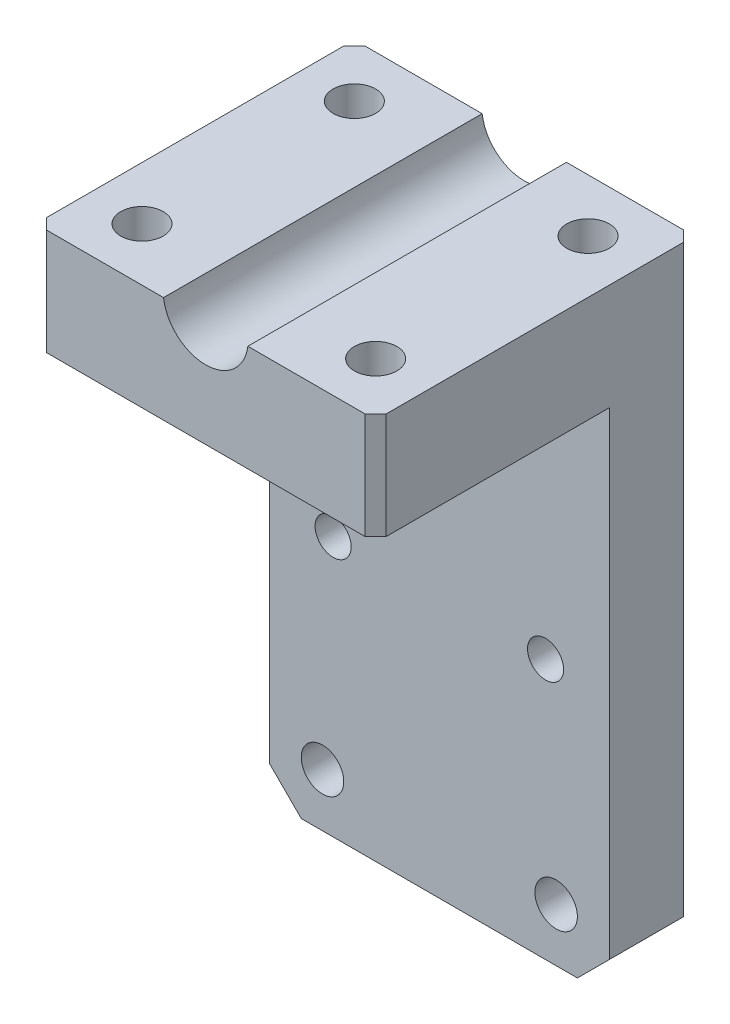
SolidWorks part; units mm, degrees
ref_plane "Aufriss" through (0, 0, 0) normal (0, 0, 1) x (1, 0, 0)
ref_plane "Grundriss" through (0, 0, 0) normal (0, 1, 0) x (1, 0, 0)
ref_plane "Seitenriss" through (0, 0, 0) normal (1, 0, 0) x (0, 0, -1)
sketch "Skizze1" plane through (0, 0, 0) normal (0, 0, 1) x (1, 0, 0)
  line L1 (-16, -29) -> (16, -29)
  line L2 (-16, -29) -> (-16, 29)
  line L3 (-16, 29) -> (16, 29)
  line L4 (16, -29) -> (16, 29)
  line L5 (-16, -29) -> (16, 29) construction
  line L6 (-16, 29) -> (16, -29) construction
  point P0 (0, 0)
  dimension "D1" = 32
  dimension "D2" = 58
extrude "Aufsatz-Linear austragen1" add sketch "Skizze1" against normal blind 30
sketch "Skizze2" plane through (16, 0, 0) normal (1, 0, 0) x (0, 0, -1)
  line L1 (22, -29) -> (0, -29)
  line L2 (22, -29) -> (22, 19)
  line L3 (22, 19) -> (0, 19)
  line L4 (0, -29) -> (0, 19)
  line L5 (30, 29) -> (0, 29) construction
  line L6 (30, -29) -> (30, 29) construction
  dimension "D1" = 10
  dimension "D2" = 8
extrude "Schnitt-Linear austragen1" cut sketch "Skizze2" against normal through all
hole_wizard "Stirnsenkung für M3 Flachkopfschraube mit Schlitz2" positions "Skizze3" profile "Skizze4" counterbore size "M3" standard "DIN"
sketch "Skizze3" plane through (0, 0, -30) normal (0, 0, 1) x (1, 0, 0)
  line L0 (-16, -29) -> (16, -29) construction
  line L1 (16, 29) -> (-16, 29) construction
  point P0 (-10, -4.5)
  point P2 (10, -4.5)
  point P11 (0, -29)
  point P12 (-10, 15.5)
  point P14 (10, 15.5)
  dimension "D1" = 10
  dimension "D2" = 10
  dimension "D3" = 20
  dimension "D4" = 13.5
sketch "Skizze4" plane through (-10, -4.5, -30) normal (1, 0, 0) x (0, 1, 0)
  line L0 (0, 0) -> (0, 30)
  line L1 (0, 30) -> (1.7, 30)
  line L3 (1.7, 30) -> (1.7, 2.4)
  line L4 (1.7, 2.4) -> (3.5, 2.4)
  line L5 (3.5, 2.4) -> (3.5, 0)
  line L7 (3.5, 0) -> (0, 0)
  line L11 (0, -6.35) -> (0, 107.95) construction
  dimension "Bohrerdurchmesser" = 3.4
  dimension "Bohrungstiefe" = 30
  dimension "Senkdurchmesser2" = 7
  dimension "Senktiefe2" = 2.4
hole_wizard "Ø4.0 (4) Durchmesser Bohrung1" positions "Skizze15" profile "Skizze16" hole size "Ø4.0" standard "DIN"
sketch "Skizze15" plane through (0, 0, -30) normal (0, 0, 1) x (1, 0, 0)
  line L3 (-16, -29) -> (-16, 19) construction
  line L4 (-16, -29) -> (16, -29) construction
  line L5 (16, -29) -> (16, 19) construction
  point P0 (-11, -24)
  point P2 (11, -24)
  dimension "D1" = 5
  dimension "D2" = 5
  dimension "D3" = 5
sketch "Skizze16" plane through (-11, -24, -30) normal (1, 0, 0) x (0, 1, 0)
  line L0 (0, 0) -> (0, 30)
  line L1 (0, 30) -> (2, 30)
  line L2 (2, 30) -> (2, 0)
  line L5 (2, 0) -> (0, 0)
  line L11 (0, -6.35) -> (0, 107.95) construction
  dimension "Bohrerdurchmesser" = 4
  dimension "Bohrungstiefe" = 30
chamfer "Fase2" distance 3 angle 45 2 edges at (-16, -29, -26) (16, -29, -26)
sketch "Skizze20" plane through (0, 0, -30) normal (0, 0, -1) x (-1, 0, 0)
  line L0 (-16, 29) -> (16, 29) construction
  circle A0 centre (0, 29.5) radius 4
  dimension "D2" = 8
  dimension "D1" = 0.5
extrude "Schnitt-Linear austragen3" cut sketch "Skizze20" against normal through all
hole_wizard "Ø4.0 (4) Durchmesser Bohrung2" positions "Skizze21" profile "Skizze22" hole size "Ø4.0" standard "DIN"
sketch "Skizze21" plane through (0, 29, 0) normal (0, 1, 0) x (1, 0, 0)
  line L0 (-16, 30) -> (-16, 0) construction
  line L1 (-3.9686, 30) -> (-16, 30) construction
  line L2 (-3.9686, 0) -> (-16, 0) construction
  line L3 (16, 30) -> (16, 0) construction
  point P0 (-11, 25)
  point P2 (11, 25)
  point P4 (11, 5)
  point P6 (-11, 5)
  dimension "D1" = 5
  dimension "D2" = 5
  dimension "D3" = 5
  dimension "D4" = 5
sketch "Skizze22" plane through (-11, 29, -25) normal (1, 0, 0) x (0, 0, 1)
  line L0 (0, 0) -> (0, 7)
  line L1 (0, 7) -> (2, 7)
  line L2 (2, 7) -> (2, 0)
  line L5 (2, 0) -> (0, 0)
  line L10 (0, 7) -> (-2, 7) construction
  line L11 (0, -6.35) -> (0, 107.95) construction
  dimension "Bohrerdurchmesser" = 4
  dimension "Bohrungstiefe" = 7
  dimension "Spitzenwinkel" = 180
chamfer "Fase3" distance 1 angle 45 7 edges at (-16, 1.5, -30) (-14.5, -27.5, -30) (0, -29, -30) (14.5, -27.5, -30) (16, 1.5, -30) (-16, 24, 0) (16, 24, 0)
